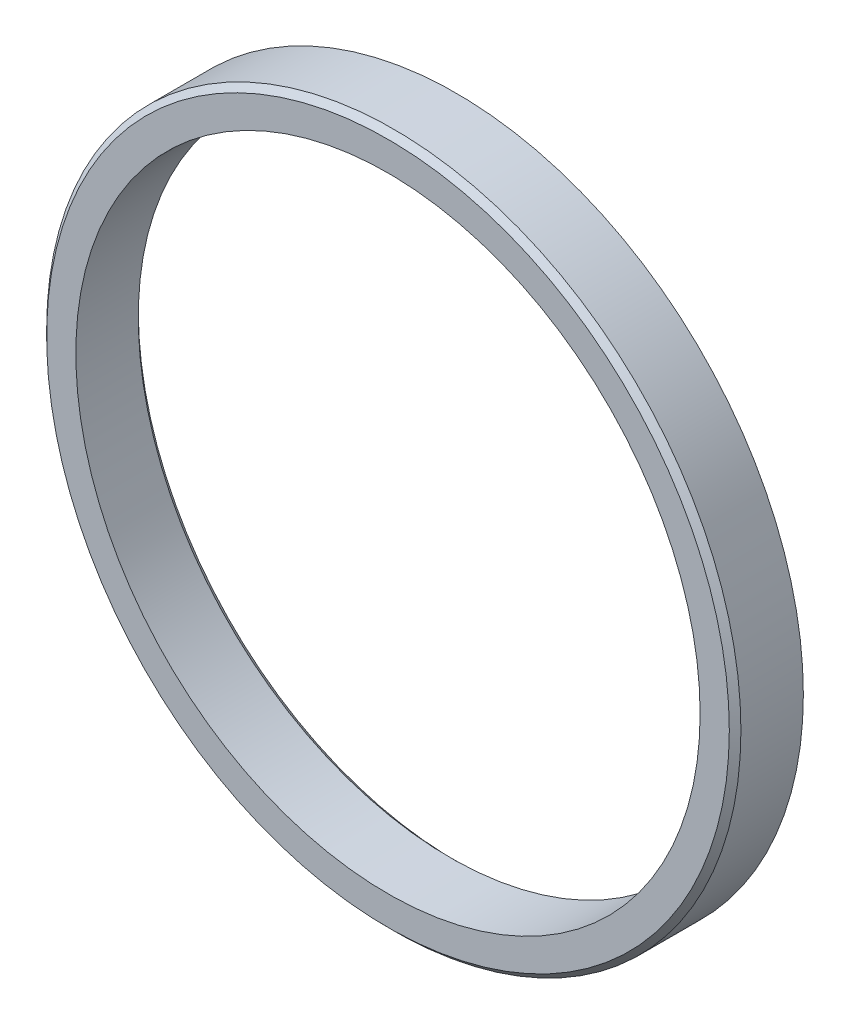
SolidWorks part; units mm, degrees
ref_plane "Front Plane" through (0, 0, 0) normal (0, 0, 1) x (1, 0, 0)
ref_plane "Top Plane" through (0, 0, 0) normal (0, 1, 0) x (1, 0, 0)
ref_plane "Right Plane" through (0, 0, 0) normal (1, 0, 0) x (0, 0, -1)
sketch "Sketch1" plane through (0, 0, 0) normal (1, 0, 0) x (0, 0, -1)
  line L0 (-66.6227, 0) -> (66.6227, 0) construction
  line L1 (-10.75, 107.5) -> (10.75, 107.5)
  line L2 (10.75, 107.5) -> (12.75, 109.5)
  line L3 (12.75, 109.5) -> (12.75, 119.55)
  line L4 (12.75, 119.55) -> (-8.75, 119.55)
  line L5 (-8.75, 119.55) -> (-10.75, 117.55)
  line L6 (-10.75, 117.55) -> (-10.75, 107.5)
  line L7 (0, -152.3213) -> (0, 152.3213) construction
  point P3 (0, 107.5)
  point P4 (0, 0)
  point P13 (0, 0)
  dimension "D1" = 45
  dimension "D2" = 45
  dimension "D3" = 2
  dimension "D4" = 2
  dimension "D5" = 215
  dimension "D6" = 239.1
  dimension "D7" = 23.5
revolve "Revolve1" add sketch "Sketch1" angle 360 about L0
